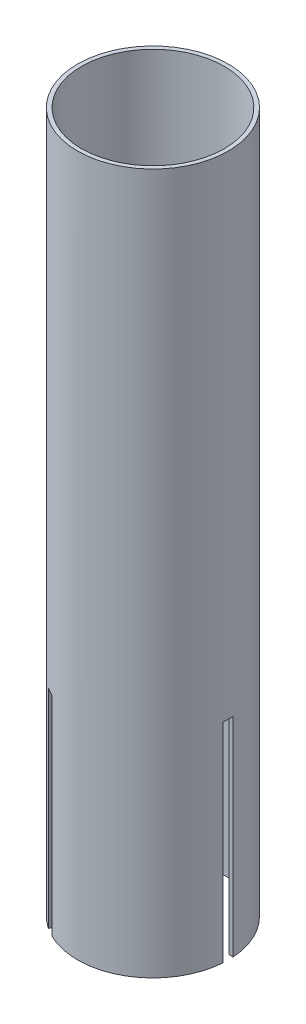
SolidWorks part; units mm, degrees
ref_plane "Front Plane" through (0, 0, 0) normal (0, 0, 1) x (1, 0, 0)
ref_plane "Top Plane" through (0, 0, 0) normal (0, 1, 0) x (1, 0, 0)
ref_plane "Right Plane" through (0, 0, 0) normal (1, 0, 0) x (0, 0, -1)
sketch "Sketch2" plane through (0, 0, 0) normal (0, 1, 0) x (1, 0, 0)
  circle A0 centre (0, 0) radius 28.702
  dimension "D1" = 57.404
extrude "Extrude-Thin1" add sketch "Sketch2" along normal blind 266.7 thin
sketch "Sketch3" plane through (0, 0, 0) normal (0, -1, 0) x (1, 0, 0)
  line L0 (0, 0) -> (0, -1.905)
  line L1 (0, -1.905) -> (31.5396, -1.905)
  line L2 (31.5396, -1.905) -> (31.5396, 1.905)
  line L3 (31.5396, 1.905) -> (0, 1.905)
  line L4 (0, 1.905) -> (0, 0)
  dimension "D1" = 3.81
  dimension "D2" = 1.905
extrude "Cut-Extrude1" cut sketch "Sketch3" against normal blind 79.375
pattern_circular "CirPattern1" count 3 over 360 about axis through (0, 0, 0) along (0, 1, 0) of "Cut-Extrude1"
